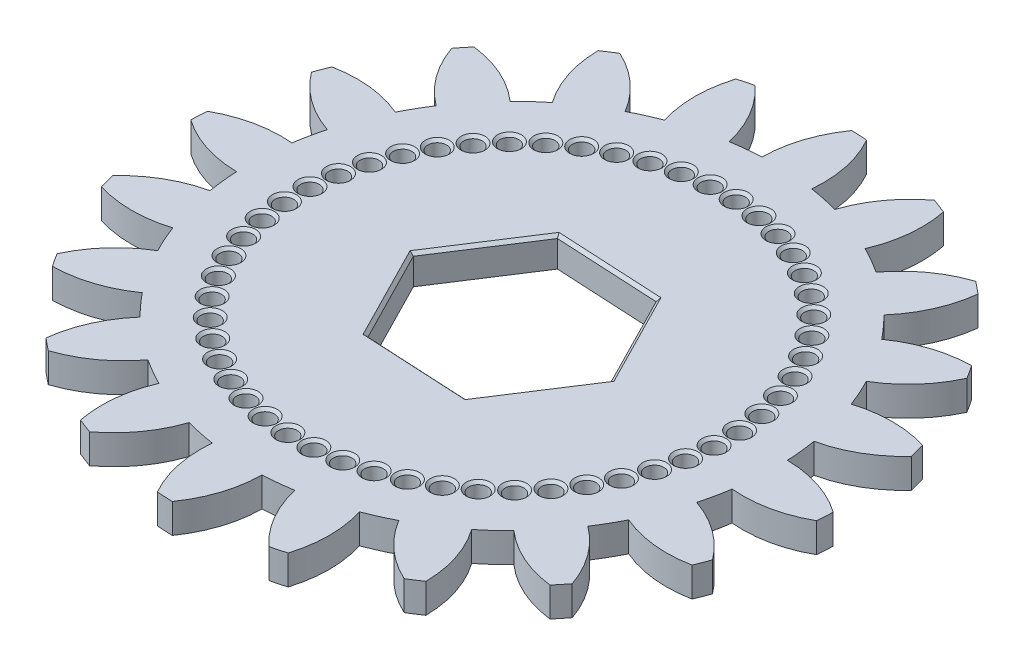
SolidWorks part; units mm, degrees
ref_plane "Front Plane" through (0, 0, 0) normal (0, 0, 1) x (1, 0, 0)
ref_plane "Top Plane" through (0, 0, 0) normal (0, 1, 0) x (1, 0, 0)
ref_plane "Right Plane" through (0, 0, 0) normal (1, 0, 0) x (0, 0, -1)
imported_body "Sun 20T"
sketch "Sketch1" plane through (0, 6.35, 0) normal (0, 1, 0) x (1, 0, 0)
  circle A0 centre (0, 0) radius 9.525
extrude "Fill" add sketch "Sketch1" against normal up to surface (6.35 mm away)
sketch "Sketch2" plane through (0, 6.35, 0) normal (0, 1, 0) x (1, 0, 0)
  line L0 (0, 0) -> (-3.6184, -69.7562) construction
  line L1 (10.0053, -19.6105) -> (21.9858, -1.1404)
  line L2 (21.9858, -1.1404) -> (11.9806, 18.4701)
  line L3 (11.9806, 18.4701) -> (-10.0053, 19.6105)
  line L4 (-10.0053, 19.6105) -> (-21.9858, 1.1404)
  line L5 (-21.9858, 1.1404) -> (-11.9806, -18.4701)
  line L6 (-11.9806, -18.4701) -> (10.0053, -19.6105)
  circle A0 centre (0, 0) radius 19.0659 construction
  arc A1 (-5.2813, -69.6501) -> (-1.9534, -69.8227) centre (0, 0) ccw construction
  dimension "D1" = 38.1317
extrude "Key Way" cut sketch "Sketch2" against normal blind 12.7
chamfer "Chamfer1" distance 0.635 angle 45 6 edges at (-0.9876, 6.35, 19.0403) (15.9955, 6.35, 10.3755) (16.9832, 6.35, -8.6648) (0.9876, 6.35, -19.0403) (-15.9955, 6.35, -10.3755) (-16.9832, 6.35, 8.6648)
sketch "Sketch3" plane through (0, 6.35, 0) normal (0, 1, 0) x (1, 0, 0)
  line L0 (-1.0205, -19.6744) -> (-2.8782, -55.4866) construction
  line L1 (10.3385, -20.2636) -> (-12.3796, -19.0852) construction
  line L2 (-1.0205, -19.6744) -> (2.8782, 55.4866) construction
  circle A0 centre (0, 0) radius 55.5612 construction
  circle A1 centre (22.9919, 38.7818) radius 1.9685
  circle A2 centre (0, 0) radius 45.085 construction
  circle A3 centre (-2.3355, -45.0245) radius 1.9685
  circle A4 centre (-7.7456, -44.4147) radius 1.9685
  circle A5 centre (-13.0427, -43.1572) radius 1.9685
  circle A6 centre (-18.1496, -41.2704) radius 1.9685
  circle A7 centre (-22.9919, -38.7818) radius 1.9685
  circle A8 centre (-27.4989, -35.7277) radius 1.9685
  circle A9 centre (-31.6049, -32.1526) radius 1.9685
  circle A10 centre (-35.25, -28.1086) radius 1.9685
  circle A11 centre (-38.3811, -23.6547) radius 1.9685
  circle A12 centre (-40.9525, -18.8559) radius 1.9685
  circle A13 centre (-42.9268, -13.7822) radius 1.9685
  circle A14 centre (-44.2751, -8.5074) radius 1.9685
  circle A15 centre (-44.9777, -3.1086) radius 1.9685
  circle A16 centre (-45.0245, 2.3355) radius 1.9685
  circle A17 centre (-44.4147, 7.7456) radius 1.9685
  circle A18 centre (-43.1572, 13.0427) radius 1.9685
  circle A19 centre (-41.2704, 18.1496) radius 1.9685
  circle A20 centre (-38.7818, 22.9919) radius 1.9685
  circle A21 centre (-35.7277, 27.4989) radius 1.9685
  circle A22 centre (-32.1526, 31.6049) radius 1.9685
  circle A23 centre (-28.1086, 35.25) radius 1.9685
  circle A24 centre (-23.6547, 38.3811) radius 1.9685
  circle A25 centre (-18.8559, 40.9525) radius 1.9685
  circle A26 centre (-13.7822, 42.9268) radius 1.9685
  circle A27 centre (-8.5074, 44.2751) radius 1.9685
  circle A28 centre (-3.1086, 44.9777) radius 1.9685
  circle A29 centre (2.3355, 45.0245) radius 1.9685
  circle A30 centre (7.7456, 44.4147) radius 1.9685
  circle A31 centre (13.0427, 43.1572) radius 1.9685
  circle A32 centre (18.1496, 41.2704) radius 1.9685
  circle A33 centre (27.4989, 35.7277) radius 1.9685
  circle A34 centre (31.6049, 32.1526) radius 1.9685
  circle A35 centre (35.25, 28.1086) radius 1.9685
  circle A36 centre (38.3811, 23.6547) radius 1.9685
  circle A37 centre (40.9525, 18.8559) radius 1.9685
  circle A38 centre (42.9268, 13.7822) radius 1.9685
  circle A39 centre (44.2751, 8.5074) radius 1.9685
  circle A40 centre (44.9777, 3.1086) radius 1.9685
  circle A41 centre (45.0245, -2.3355) radius 1.9685
  circle A42 centre (44.4147, -7.7456) radius 1.9685
  circle A43 centre (43.1572, -13.0427) radius 1.9685
  circle A44 centre (41.2704, -18.1496) radius 1.9685
  circle A45 centre (38.7818, -22.9919) radius 1.9685
  circle A46 centre (35.7277, -27.4989) radius 1.9685
  circle A47 centre (32.1526, -31.6049) radius 1.9685
  circle A48 centre (28.1086, -35.25) radius 1.9685
  circle A49 centre (23.6547, -38.3811) radius 1.9685
  circle A50 centre (18.8559, -40.9525) radius 1.9685
  circle A51 centre (13.7822, -42.9268) radius 1.9685
  circle A52 centre (8.5074, -44.2751) radius 1.9685
  circle A53 centre (3.1086, -44.9777) radius 1.9685
  point P10 (-1.9494, -37.5805)
  point P73 (0, 0)
  dimension "D1" = 3.937
  dimension "D3" = 90.17
  dimension "D2" = 52
extrude "Cut-Extrude1" cut sketch "Sketch3" against normal blind 4.064
chamfer "Chamfer2" distance 0.5715 angle 45 52 edges at (-40.7503, 6.35, -22.9919) (-43.2389, 6.35, -18.1496) (-34.1211, 6.35, -31.6049) (-37.6962, 6.35, -27.4989) (-46.993, 6.35, -2.3355) (-46.9462, 6.35, 3.1086) (-45.1257, 6.35, -13.0427) (-46.3832, 6.35, -7.7456) (-5.0771, 6.35, -44.9777) (-10.4759, 6.35, -44.2751) (5.7771, 6.35, -44.4147) (0.367, 6.35, -45.0245) (-25.6232, 6.35, -38.3811) (-30.0771, 6.35, -35.25) (-15.7507, 6.35, -42.9268) (-20.8244, 6.35, -40.9525) (11.8137, 6.35, 42.9268) (-33.5734, 6.35, 32.1526) (-37.2185, 6.35, 28.1086) (-24.9604, 6.35, 38.7818) (30.1841, 6.35, 31.6049) (6.5389, 6.35, 44.2751) (1.1401, 6.35, 44.9777) (16.8874, 6.35, 40.9525) (-42.921, 6.35, 18.8559) (-15.0112, 6.35, 43.1572) (-20.1181, 6.35, 41.2704) (-9.7141, 6.35, 44.4147) (-29.4674, 6.35, 35.7277) (-44.8953, 6.35, 13.7822) (-46.2436, 6.35, 8.5074) (-40.3496, 6.35, 23.6547) (40.9583, 6.35, -13.7822) (43.056, 6.35, 2.3355) (43.0092, 6.35, -3.1086) (29.6364, 6.35, -32.1526) (38.984, 6.35, -18.8559) (36.4126, 6.35, -23.6547) (16.1811, 6.35, -41.2704) (33.7592, 6.35, 27.4989) (21.6862, 6.35, 38.3811) (26.1401, 6.35, 35.25) (33.2815, 6.35, -28.1086) (42.4462, 6.35, 7.7456) (36.8133, 6.35, 22.9919) (39.3019, 6.35, 18.1496) (42.3066, 6.35, -8.5074) (11.0742, 6.35, -43.1572) (25.5304, 6.35, -35.7277) (21.0234, 6.35, -38.7818) (41.1887, 6.35, 13.0427) (-4.304, 6.35, 45.0245)
sketch "Sketch4" plane through (0, 0, 0) normal (0, -1, 0) x (1, 0, 0)
  arc A160 (-29.8922, 49.8218) -> (-43.11, 58.1536) centre (-50.8058, 31.2944) ccw
  arc A161 (-43.11, 58.1536) -> (-47.8617, 54.31) centre (0, 0) ccw
  arc A162 (-47.8617, 54.31) -> (-42.4758, 39.643) centre (-19.9873, 56.2234) ccw
  arc A163 (-42.4758, 39.643) -> (-43.8249, 38.1461) centre (0, 0) ccw
  arc A164 (-43.8249, 38.1461) -> (-58.9705, 41.9857) centre (-57.9897, 14.0629) ccw
  arc A165 (-58.9705, 41.9857) -> (-62.3019, 36.8618) centre (0, 0) ccw
  arc A166 (-62.3019, 36.8618) -> (-52.6472, 24.577) centre (-36.383, 47.2953) ccw
  arc A167 (-52.6472, 24.577) -> (-53.4678, 22.7365) centre (0, 0) ccw
  arc A168 (-53.4678, 22.7365) -> (-69.0585, 21.7078) centre (-59.4971, -4.5452) ccw
  arc A169 (-69.0585, 21.7078) -> (-70.6435, 15.8053) centre (0, 0) ccw
  arc A170 (-70.6435, 15.8053) -> (-57.6651, 7.1052) centre (-49.2174, 33.7375) ccw
  arc A171 (-57.6651, 7.1052) -> (-57.8769, 5.1012) centre (0, 0) ccw
  arc A172 (-57.8769, 5.1012) -> (-72.3867, -0.6949) centre (-55.1806, -22.7084) ccw
  arc A173 (-72.3867, -0.6949) -> (-72.0701, -6.7983) centre (0, 0) ccw
  arc A174 (-72.0701, -6.7983) -> (-57.0384, -11.0621) centre (-57.2339, 16.8773) ccw
  arc A175 (-57.0384, -11.0621) -> (-56.6205, -13.0334) centre (0, 0) ccw
  arc A176 (-56.6205, -13.0334) -> (-68.6291, -23.0296) centre (-45.4626, -38.6487) ccw
  arc A177 (-68.6291, -23.0296) -> (-66.4419, -28.7365) centre (0, 0) ccw
  arc A178 (-66.4419, -28.7365) -> (-50.8284, -28.1465) centre (-59.6481, -1.635) ccw
  arc A179 (-50.8284, -28.1465) -> (-49.8218, -29.8922) centre (0, 0) ccw
  arc A180 (-49.8218, -29.8922) -> (-58.1536, -43.11) centre (-31.2944, -50.8058) ccw
  arc A181 (-58.1536, -43.11) -> (-54.31, -47.8617) centre (0, 0) ccw
  arc A182 (-54.31, -47.8617) -> (-39.643, -42.4758) centre (-56.2234, -19.9873) ccw
  arc A183 (-39.643, -42.4758) -> (-38.1461, -43.8249) centre (0, 0) ccw
  arc A184 (-38.1461, -43.8249) -> (-41.9857, -58.9705) centre (-14.0629, -57.9897) ccw
  arc A185 (-41.9857, -58.9705) -> (-36.8618, -62.3019) centre (0, 0) ccw
  arc A186 (-36.8618, -62.3019) -> (-24.577, -52.6472) centre (-47.2953, -36.383) ccw
  arc A187 (-24.577, -52.6472) -> (-22.7365, -53.4678) centre (0, 0) ccw
  arc A188 (-22.7365, -53.4678) -> (-21.7078, -69.0585) centre (4.5452, -59.4971) ccw
  arc A189 (-21.7078, -69.0585) -> (-15.8053, -70.6435) centre (0, 0) ccw
  arc A190 (-15.8053, -70.6435) -> (-7.1052, -57.6651) centre (-33.7375, -49.2174) ccw
  arc A191 (-7.1052, -57.6651) -> (-5.1012, -57.8769) centre (0, 0) ccw
  arc A192 (-5.1012, -57.8769) -> (0.6949, -72.3867) centre (22.7084, -55.1806) ccw
  arc A193 (0.6949, -72.3867) -> (6.7983, -72.0701) centre (0, 0) ccw
  arc A194 (6.7983, -72.0701) -> (11.0621, -57.0384) centre (-16.8773, -57.2339) ccw
  arc A195 (11.0621, -57.0384) -> (13.0334, -56.6205) centre (0, 0) ccw
  arc A196 (13.0334, -56.6205) -> (23.0296, -68.6291) centre (38.6487, -45.4626) ccw
  arc A197 (23.0296, -68.6291) -> (28.7365, -66.4419) centre (0, 0) ccw
  arc A198 (28.7365, -66.4419) -> (28.1465, -50.8284) centre (1.635, -59.6481) ccw
  arc A199 (28.1465, -50.8284) -> (29.8922, -49.8218) centre (0, 0) ccw
  arc A200 (29.8922, -49.8218) -> (43.11, -58.1536) centre (50.8058, -31.2944) ccw
  arc A201 (43.11, -58.1536) -> (47.8617, -54.31) centre (0, 0) ccw
  arc A202 (47.8617, -54.31) -> (42.4758, -39.643) centre (19.9873, -56.2234) ccw
  arc A203 (42.4758, -39.643) -> (43.8249, -38.1461) centre (0, 0) ccw
  arc A204 (43.8249, -38.1461) -> (58.9705, -41.9857) centre (57.9897, -14.0629) ccw
  arc A205 (58.9705, -41.9857) -> (62.3019, -36.8618) centre (0, 0) ccw
  arc A206 (62.3019, -36.8618) -> (52.6472, -24.577) centre (36.383, -47.2953) ccw
  arc A207 (52.6472, -24.577) -> (53.4678, -22.7365) centre (0, 0) ccw
  arc A208 (53.4678, -22.7365) -> (69.0585, -21.7078) centre (59.4971, 4.5452) ccw
  arc A209 (69.0585, -21.7078) -> (70.6435, -15.8053) centre (0, 0) ccw
  arc A210 (70.6435, -15.8053) -> (57.6651, -7.1052) centre (49.2174, -33.7375) ccw
  arc A211 (57.6651, -7.1052) -> (57.8769, -5.1012) centre (0, 0) ccw
  arc A212 (57.8769, -5.1012) -> (72.3867, 0.6949) centre (55.1806, 22.7084) ccw
  arc A213 (72.3867, 0.6949) -> (72.0701, 6.7983) centre (0, 0) ccw
  arc A214 (72.0701, 6.7983) -> (57.0384, 11.0621) centre (57.2339, -16.8773) ccw
  arc A215 (57.0384, 11.0621) -> (56.6205, 13.0334) centre (0, 0) ccw
  arc A216 (56.6205, 13.0334) -> (68.6291, 23.0296) centre (45.4626, 38.6487) ccw
  arc A217 (68.6291, 23.0296) -> (66.4419, 28.7365) centre (0, 0) ccw
  arc A218 (66.4419, 28.7365) -> (50.8284, 28.1465) centre (59.6481, 1.635) ccw
  arc A219 (50.8284, 28.1465) -> (49.8218, 29.8922) centre (0, 0) ccw
  arc A220 (49.8218, 29.8922) -> (58.1536, 43.11) centre (31.2944, 50.8058) ccw
  arc A221 (58.1536, 43.11) -> (54.31, 47.8617) centre (0, 0) ccw
  arc A222 (54.31, 47.8617) -> (39.643, 42.4758) centre (56.2234, 19.9873) ccw
  arc A223 (39.643, 42.4758) -> (38.1461, 43.8249) centre (0, 0) ccw
  arc A224 (38.1461, 43.8249) -> (41.9857, 58.9705) centre (14.0629, 57.9897) ccw
  arc A225 (41.9857, 58.9705) -> (36.8618, 62.3019) centre (0, 0) ccw
  arc A226 (36.8618, 62.3019) -> (24.577, 52.6472) centre (47.2953, 36.383) ccw
  arc A227 (24.577, 52.6472) -> (22.7365, 53.4678) centre (0, 0) ccw
  arc A228 (22.7365, 53.4678) -> (21.7078, 69.0585) centre (-4.5452, 59.4971) ccw
  arc A229 (21.7078, 69.0585) -> (15.8053, 70.6435) centre (0, 0) ccw
  arc A230 (15.8053, 70.6435) -> (7.1052, 57.6651) centre (33.7375, 49.2174) ccw
  arc A231 (7.1052, 57.6651) -> (5.1012, 57.8769) centre (0, 0) ccw
  arc A232 (5.1012, 57.8769) -> (-0.6949, 72.3867) centre (-22.7084, 55.1806) ccw
  arc A233 (-0.6949, 72.3867) -> (-6.7983, 72.0701) centre (0, 0) ccw
  arc A234 (-6.7983, 72.0701) -> (-11.0621, 57.0384) centre (16.8773, 57.2339) ccw
  arc A235 (-11.0621, 57.0384) -> (-13.0334, 56.6205) centre (0, 0) ccw
  arc A236 (-13.0334, 56.6205) -> (-23.0296, 68.6291) centre (-38.6487, 45.4626) ccw
  arc A237 (-23.0296, 68.6291) -> (-28.7365, 66.4419) centre (0, 0) ccw
  arc A238 (-28.7365, 66.4419) -> (-28.1465, 50.8284) centre (-1.635, 59.6481) ccw
  arc A239 (-28.1465, 50.8284) -> (-29.8922, 49.8218) centre (0, 0) ccw
  arc A240 (-29.8922, 49.8218) -> (-43.11, 58.1536) centre (-50.8058, 31.2944) ccw
  arc A241 (-43.11, 58.1536) -> (-47.8617, 54.31) centre (0, 0) ccw
  arc A242 (-47.8617, 54.31) -> (-42.4758, 39.643) centre (-19.9873, 56.2234) ccw
  arc A243 (-42.4758, 39.643) -> (-43.8249, 38.1461) centre (0, 0) ccw
  arc A244 (-43.8249, 38.1461) -> (-58.9705, 41.9857) centre (-57.9897, 14.0629) ccw
  arc A245 (-58.9705, 41.9857) -> (-62.3019, 36.8618) centre (0, 0) ccw
  arc A246 (-62.3019, 36.8618) -> (-52.6472, 24.577) centre (-36.383, 47.2953) ccw
  arc A247 (-52.6472, 24.577) -> (-53.4678, 22.7365) centre (0, 0) ccw
  arc A248 (-53.4678, 22.7365) -> (-69.0585, 21.7078) centre (-59.4971, -4.5452) ccw
  arc A249 (-69.0585, 21.7078) -> (-70.6435, 15.8053) centre (0, 0) ccw
  arc A250 (-70.6435, 15.8053) -> (-57.6651, 7.1052) centre (-49.2174, 33.7375) ccw
  arc A251 (-57.6651, 7.1052) -> (-57.8769, 5.1012) centre (0, 0) ccw
  arc A252 (-57.8769, 5.1012) -> (-72.3867, -0.6949) centre (-55.1806, -22.7084) ccw
  arc A253 (-72.3867, -0.6949) -> (-72.0701, -6.7983) centre (0, 0) ccw
  arc A254 (-72.0701, -6.7983) -> (-57.0384, -11.0621) centre (-57.2339, 16.8773) ccw
  arc A255 (-57.0384, -11.0621) -> (-56.6205, -13.0334) centre (0, 0) ccw
  arc A256 (-56.6205, -13.0334) -> (-68.6291, -23.0296) centre (-45.4626, -38.6487) ccw
  arc A257 (-68.6291, -23.0296) -> (-66.4419, -28.7365) centre (0, 0) ccw
  arc A258 (-66.4419, -28.7365) -> (-50.8284, -28.1465) centre (-59.6481, -1.635) ccw
  arc A259 (-50.8284, -28.1465) -> (-49.8218, -29.8922) centre (0, 0) ccw
  arc A260 (-49.8218, -29.8922) -> (-58.1536, -43.11) centre (-31.2944, -50.8058) ccw
  arc A261 (-58.1536, -43.11) -> (-54.31, -47.8617) centre (0, 0) ccw
  arc A262 (-54.31, -47.8617) -> (-39.643, -42.4758) centre (-56.2234, -19.9873) ccw
  arc A263 (-39.643, -42.4758) -> (-38.1461, -43.8249) centre (0, 0) ccw
  arc A264 (-38.1461, -43.8249) -> (-41.9857, -58.9705) centre (-14.0629, -57.9897) ccw
  arc A265 (-41.9857, -58.9705) -> (-36.8618, -62.3019) centre (0, 0) ccw
  arc A266 (-36.8618, -62.3019) -> (-24.577, -52.6472) centre (-47.2953, -36.383) ccw
  arc A267 (-24.577, -52.6472) -> (-22.7365, -53.4678) centre (0, 0) ccw
  arc A268 (-22.7365, -53.4678) -> (-21.7078, -69.0585) centre (4.5452, -59.4971) ccw
  arc A269 (-21.7078, -69.0585) -> (-15.8053, -70.6435) centre (0, 0) ccw
  arc A270 (-15.8053, -70.6435) -> (-7.1052, -57.6651) centre (-33.7375, -49.2174) ccw
  arc A271 (-7.1052, -57.6651) -> (-5.1012, -57.8769) centre (0, 0) ccw
  arc A272 (-5.1012, -57.8769) -> (0.6949, -72.3867) centre (22.7084, -55.1806) ccw
  arc A273 (0.6949, -72.3867) -> (6.7983, -72.0701) centre (0, 0) ccw
  arc A274 (6.7983, -72.0701) -> (11.0621, -57.0384) centre (-16.8773, -57.2339) ccw
  arc A275 (11.0621, -57.0384) -> (13.0334, -56.6205) centre (0, 0) ccw
  arc A276 (13.0334, -56.6205) -> (23.0296, -68.6291) centre (38.6487, -45.4626) ccw
  arc A277 (23.0296, -68.6291) -> (28.7365, -66.4419) centre (0, 0) ccw
  arc A278 (28.7365, -66.4419) -> (28.1465, -50.8284) centre (1.635, -59.6481) ccw
  arc A279 (28.1465, -50.8284) -> (29.8922, -49.8218) centre (0, 0) ccw
  arc A280 (29.8922, -49.8218) -> (43.11, -58.1536) centre (50.8058, -31.2944) ccw
  arc A281 (43.11, -58.1536) -> (47.8617, -54.31) centre (0, 0) ccw
  arc A282 (47.8617, -54.31) -> (42.4758, -39.643) centre (19.9873, -56.2234) ccw
  arc A283 (42.4758, -39.643) -> (43.8249, -38.1461) centre (0, 0) ccw
  arc A284 (43.8249, -38.1461) -> (58.9705, -41.9857) centre (57.9897, -14.0629) ccw
  arc A285 (58.9705, -41.9857) -> (62.3019, -36.8618) centre (0, 0) ccw
  arc A286 (62.3019, -36.8618) -> (52.6472, -24.577) centre (36.383, -47.2953) ccw
  arc A287 (52.6472, -24.577) -> (53.4678, -22.7365) centre (0, 0) ccw
  arc A288 (53.4678, -22.7365) -> (69.0585, -21.7078) centre (59.4971, 4.5452) ccw
  arc A289 (69.0585, -21.7078) -> (70.6435, -15.8053) centre (0, 0) ccw
  arc A290 (70.6435, -15.8053) -> (57.6651, -7.1052) centre (49.2174, -33.7375) ccw
  arc A291 (57.6651, -7.1052) -> (57.8769, -5.1012) centre (0, 0) ccw
  arc A292 (57.8769, -5.1012) -> (72.3867, 0.6949) centre (55.1806, 22.7084) ccw
  arc A293 (72.3867, 0.6949) -> (72.0701, 6.7983) centre (0, 0) ccw
  arc A294 (72.0701, 6.7983) -> (57.0384, 11.0621) centre (57.2339, -16.8773) ccw
  arc A295 (57.0384, 11.0621) -> (56.6205, 13.0334) centre (0, 0) ccw
  arc A296 (56.6205, 13.0334) -> (68.6291, 23.0296) centre (45.4626, 38.6487) ccw
  arc A297 (68.6291, 23.0296) -> (66.4419, 28.7365) centre (0, 0) ccw
  arc A298 (66.4419, 28.7365) -> (50.8284, 28.1465) centre (59.6481, 1.635) ccw
  arc A299 (50.8284, 28.1465) -> (49.8218, 29.8922) centre (0, 0) ccw
  arc A300 (49.8218, 29.8922) -> (58.1536, 43.11) centre (31.2944, 50.8058) ccw
  arc A301 (58.1536, 43.11) -> (54.31, 47.8617) centre (0, 0) ccw
  arc A302 (54.31, 47.8617) -> (39.643, 42.4758) centre (56.2234, 19.9873) ccw
  arc A303 (39.643, 42.4758) -> (38.1461, 43.8249) centre (0, 0) ccw
  arc A304 (38.1461, 43.8249) -> (41.9857, 58.9705) centre (14.0629, 57.9897) ccw
  arc A305 (41.9857, 58.9705) -> (36.8618, 62.3019) centre (0, 0) ccw
  arc A306 (36.8618, 62.3019) -> (24.577, 52.6472) centre (47.2953, 36.383) ccw
  arc A307 (24.577, 52.6472) -> (22.7365, 53.4678) centre (0, 0) ccw
  arc A308 (22.7365, 53.4678) -> (21.7078, 69.0585) centre (-4.5452, 59.4971) ccw
  arc A309 (21.7078, 69.0585) -> (15.8053, 70.6435) centre (0, 0) ccw
  arc A310 (15.8053, 70.6435) -> (7.1052, 57.6651) centre (33.7375, 49.2174) ccw
  arc A311 (7.1052, 57.6651) -> (5.1012, 57.8769) centre (0, 0) ccw
  arc A312 (5.1012, 57.8769) -> (-0.6949, 72.3867) centre (-22.7084, 55.1806) ccw
  arc A313 (-0.6949, 72.3867) -> (-6.7983, 72.0701) centre (0, 0) ccw
  arc A314 (-6.7983, 72.0701) -> (-11.0621, 57.0384) centre (16.8773, 57.2339) ccw
  arc A315 (-11.0621, 57.0384) -> (-13.0334, 56.6205) centre (0, 0) ccw
  arc A316 (-13.0334, 56.6205) -> (-23.0296, 68.6291) centre (-38.6487, 45.4626) ccw
  arc A317 (-23.0296, 68.6291) -> (-28.7365, 66.4419) centre (0, 0) ccw
  arc A318 (-28.7365, 66.4419) -> (-28.1465, 50.8284) centre (-1.635, 59.6481) ccw
  arc A319 (-28.1465, 50.8284) -> (-29.8922, 49.8218) centre (0, 0) ccw
  dimension "D1" = 2.54
extrude "Cut-Extrude2" cut sketch "Sketch4" against normal blind 0.127
